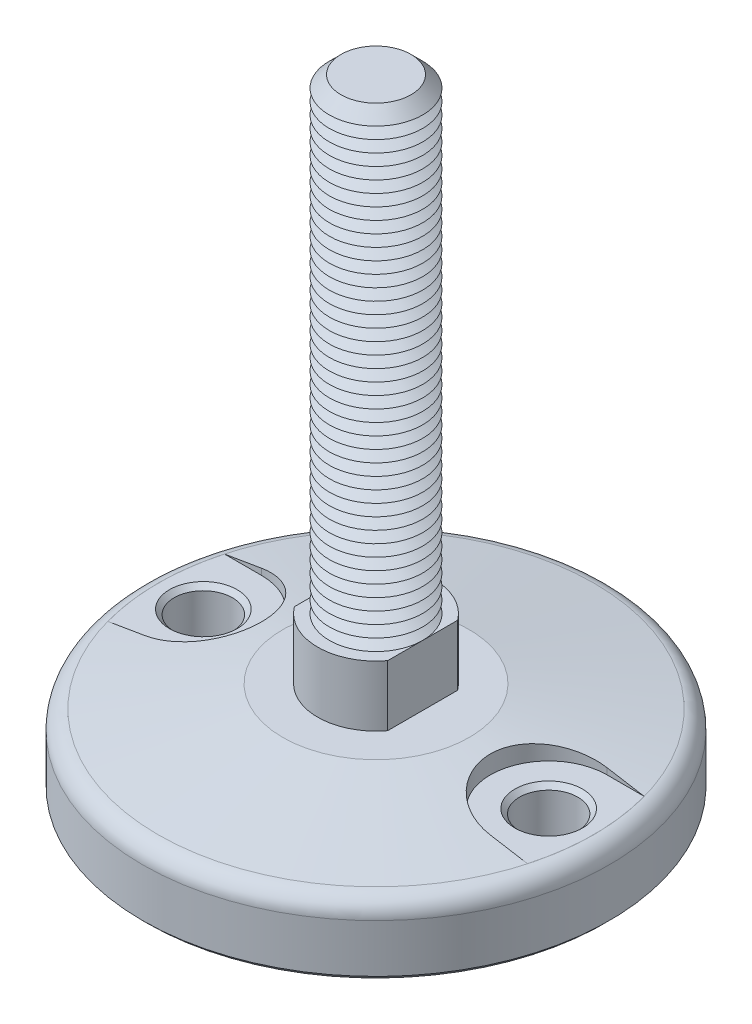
SolidWorks part; units mm, degrees
ref_plane "Front Plane" through (0, 0, 0) normal (0, 0, 1) x (1, 0, 0)
ref_plane "Top Plane" through (0, 0, 0) normal (0, 1, 0) x (1, 0, 0)
ref_plane "Right Plane" through (0, 0, 0) normal (1, 0, 0) x (0, 0, -1)
sketch "Sketch1" plane through (0, 0, 0) normal (1, 0, 0) x (0, 0, -1)
  line L0 (0, 61.3389) -> (0, -58.404) construction
sketch "Sketch2" plane through (0, 0, 0) normal (1, 0, 0) x (0, 0, -1)
  line L0 (0, 0) -> (-20, 0)
  line L1 (-20, 0) -> (-50, -5.2898)
  line L2 (-50, -5.2898) -> (-50, -20)
  line L3 (-50, -20) -> (0, -20)
  line L4 (0, 61.3389) -> (0, -58.404) construction
  line L5 (0, -20) -> (0, 0)
  dimension "D1" = 20
  dimension "D2" = 50
  dimension "D3" = 20
  dimension "D4" = 10
revolve "Revolve1" add sketch "Sketch2" angle 360 about L0
fillet "Fillet1" radius 4 1 edges at (0, -5.2898, 50)
sketch "Sketch3" plane through (0, 0, 0) normal (0, 1, 0) x (1, 0, 0)
  circle A0 centre (0, 0) radius 12.5
  dimension "D1" = 25
extrude "Boss-Extrude1" add sketch "Sketch3" along normal blind 13
sketch "Sketch4" plane through (0, 13, 0) normal (0, 1, 0) x (1, 0, 0)
  line L0 (-10, 7.5) -> (-10, -7.5)
  line L2 (10, -7.5) -> (10, 7.5)
  arc A0 (-10, 7.5) -> (-10, -7.5) centre (0, 0) ccw
  circle A1 centre (0, 0) radius 12.5 construction
  arc A2 (10, -7.5) -> (10, 7.5) centre (0, 0) ccw
  dimension "D1" = 20
extrude "Cut-Extrude1" cut sketch "Sketch4" against normal blind 13
sketch "Sketch5" plane through (0, 13, 0) normal (0, 1, 0) x (1, 0, 0)
  circle A0 centre (0, 0) radius 10
  dimension "D1" = 20
extrude "Boss-Extrude2" add sketch "Sketch5" along normal blind 100
chamfer "Chamfer1" distance 2.5 angle 45 1 edges at (0, 113, 10)
sketch "Sketch6" plane through (0, 0, 0) normal (1, 0, 0) x (0, 0, -1)
  line L0 (-10, 13) -> (-7.8349, 14.25)
  line L1 (-7.8349, 14.25) -> (-10, 15.5)
  line L2 (-10, 110.5) -> (-10, 13) construction
  line L3 (-10, 15.5) -> (-10, 13)
  dimension "D1" = 2.5
revolve "Cut-Revolve1" cut sketch "Sketch6" angle 360 about L0
pattern_linear "LPattern1" count 39 spacing 2.5 along (0, 1, 0) of "Cut-Revolve1"
sketch "Sketch8" plane through (0, 0, 0) normal (0, 1, 0) x (1, 0, 0)
  line L0 (-37, 12.5) -> (-44.9904, 12.5)
  line L1 (-37, -12.5) -> (-44.9904, -12.5)
  arc A1 (-44.9904, 12.5) -> (-44.9904, -12.5) centre (0, 0) ccw
  circle A2 centre (0, 0) radius 46.6946 construction
  arc A3 (-37, -12.5) -> (-37, 12.5) centre (-37, 0) ccw
  point P3 (-37, 0)
  point P11 (0, 0)
  dimension "D1" = 37
  dimension "D2" = 25
extrude "Cut-Extrude4" cut sketch "Sketch8" against normal blind 4.7
sketch "Sketch10" plane through (0, -4.7, 0) normal (0, 1, 0) x (1, 0, 0)
  circle A0 centre (-37, 0) radius 6.25
  dimension "D1" = 12.5
extrude "Cut-Extrude5" cut sketch "Sketch10" against normal up to surface (15.3 mm away)
chamfer "Chamfer2" distance 1 angle 45 2 edges at (-37, -20, -6.25) (-37, -4.7, 6.25)
mirror "Mirror1" about plane through (0, 0, 0) normal (1, 0, 0) of "Chamfer2", "Cut-Extrude5", "Cut-Extrude4"
chamfer "Chamfer3" distance 1 angle 45 1 edges at (0, -20, 50)
